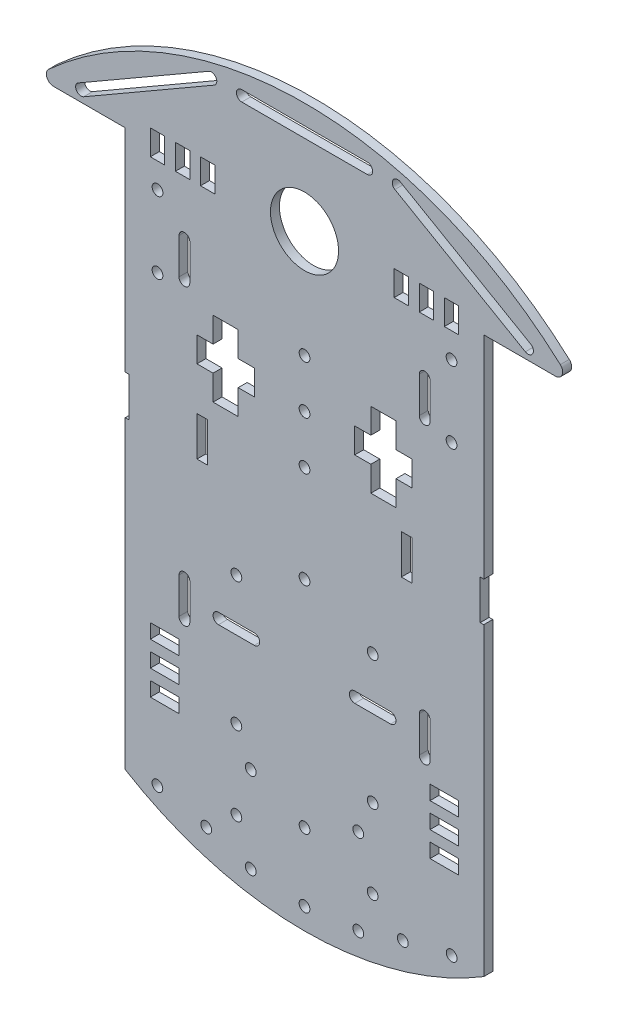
SolidWorks part; units mm, degrees
ref_plane "Plan de face" through (0, 0, 0) normal (0, 0, 1) x (1, 0, 0)
ref_plane "Plan de dessus" through (0, 0, 0) normal (0, 1, 0) x (1, 0, 0)
ref_plane "Plan de droite" through (0, 0, 0) normal (1, 0, 0) x (0, 0, -1)
sketch "Esquisse1" plane through (0, 0, 0) normal (0, 0, 1) x (1, 0, 0)
  line L0 (100, 155) -> (119.9942, 155)
  line L1 (100, 77.5) -> (0, 77.5) construction
  line L2 (0, 0) -> (0, 155)
  line L3 (0, 155) -> (-19.9942, 155)
  line L4 (100, 0) -> (100, 155)
  line L5 (125, 155) -> (-25, 155) construction
  line L6 (125, 186) -> (-25, 186) construction
  line L7 (50, -14) -> (169.1274, -14) construction
  line L8 (50, 155) -> (50, 123.7315) construction
  arc A0 (121.3374, 158.4819) -> (-21.3374, 158.4819) centre (50, 79.7742) ccw
  arc A1 (100, 0) -> (0, 0) centre (50, 82.2857) cw
  arc A2 (-21.3374, 158.4819) -> (-19.9942, 155) centre (-19.9942, 157) ccw
  arc A3 (119.9942, 155) -> (121.3374, 158.4819) centre (119.9942, 157) ccw
  dimension "D3" = 200
  dimension "D5" = 31
  dimension "D1" = 2
  dimension "D2" = 100
  dimension "D4" = 150
  dimension "D6" = 155
extrude "Boss.-Extru.1" add sketch "Esquisse1" along normal blind 2.5 contours L4 L0 A3 A0 A2 L3 L2 A1
sketch "Esquisse2" plane through (0, 0, 0) normal (0, 0, -1) x (-1, 0, 0)
  line L0 (-100, 155) -> (0, 155) construction
  line L1 (-50, 155) -> (-50, 122.9953) construction
  circle A0 centre (-50, 155) radius 9.5
  point P6 (-50, 155)
  dimension "D1" = 19
extrude "Enlèv. mat.-Extru.1" cut sketch "Esquisse2" against normal through all
sketch "Esquisse3" plane through (0, 0, 0) normal (0, 0, -1) x (-1, 0, 0)
  line L1 (-93, 158.5) -> (-89, 158.5)
  line L2 (-93, 158.5) -> (-93, 151.5)
  line L3 (-93, 151.5) -> (-89, 151.5)
  line L4 (-89, 158.5) -> (-89, 151.5)
  line L5 (-100, 0) -> (-100, 155) construction
  line L11 (-100, 155) -> (-88.6993, 155) construction
  point P8 (-93, 155)
  dimension "D1" = 7
  dimension "D2" = 4
  dimension "D3" = 7
extrude "Enlèv. mat.-Extru.2" cut sketch "Esquisse3" against normal through all
pattern_linear "Répétition linéaire1" count 3 spacing 7 along (-1, 0, 0) of "Enlèv. mat.-Extru.2"
sketch "Esquisse4" plane through (0, 0, 0) normal (0, 0, -1) x (-1, 0, 0)
  line L0 (-75.5, 122) -> (-68.5, 122)
  line L1 (-68.5, 122) -> (-68.5, 115)
  line L2 (-68.5, 115) -> (-64, 115)
  line L3 (-64, 115) -> (-64, 108)
  line L4 (-64, 108) -> (-68.5, 108)
  line L5 (-68.5, 108) -> (-68.5, 101)
  line L6 (-68.5, 101) -> (-75.5, 101)
  line L7 (-75.5, 101) -> (-75.5, 108)
  line L8 (-75.5, 108) -> (-80, 108)
  line L9 (-80, 108) -> (-80, 115)
  line L10 (-80, 115) -> (-75.5, 115)
  line L11 (-75.5, 115) -> (-75.5, 122)
  line L12 (-100, 155) -> (-119.9942, 155) construction
  line L13 (-72, 122) -> (-72, 101) construction
  line L14 (-80, 111.5) -> (-64, 111.5) construction
  line L15 (-100, 0) -> (-100, 155) construction
  point P19 (-72, 111.5)
  point P21 (-72, 111.5)
  dimension "D1" = 47
  dimension "D2" = 7
  dimension "D3" = 16
  dimension "D4" = 21
  dimension "D5" = 7
  dimension "D6" = 20
extrude "Enlèv. mat.-Extru.3" cut sketch "Esquisse4" against normal through all
sketch "Esquisse5" plane through (0, 0, 0) normal (0, 0, -1) x (-1, 0, 0)
  line L0 (-80, 108) -> (-75.5, 108) construction
  line L1 (-80, 96) -> (-77, 96)
  line L2 (-80, 96) -> (-80, 85)
  line L3 (-80, 85) -> (-77, 85)
  line L4 (-77, 96) -> (-77, 85)
  line L5 (-100, 0) -> (-100, 155) construction
  dimension "D1" = 12
  dimension "D2" = 3
  dimension "D3" = 11
  dimension "D4" = 20
extrude "Enlèv. mat.-Extru.4" cut sketch "Esquisse5" against normal through all
pattern_linear "Répétition linéaire2" count 2 spacing 22 along (1, 0, 0) of "Enlèv. mat.-Extru.4"
sketch "Esquisse6" plane through (0, 0, 0) normal (0, 0, -1) x (-1, 0, 0)
  line L0 (-65, 17.5) -> (-65, 7.0648) construction
  line L1 (-100, 0) -> (-100, 85) construction
  line L2 (-83.5, 54.5) -> (-83.5, 44.5) construction
  line L3 (-82, 54.5) -> (-82, 44.5)
  line L4 (-85, 54.5) -> (-85, 44.5)
  line L5 (-74, 49.5) -> (-64, 49.5) construction
  line L6 (-74, 51) -> (-64, 51)
  line L7 (-74, 48) -> (-64, 48)
  line L8 (-83.5, 136.5) -> (-83.5, 126.5) construction
  line L9 (-82, 136.5) -> (-82, 126.5)
  line L10 (-85, 136.5) -> (-85, 126.5)
  line L11 (-112.3374, 158) -> (-75.9643, 179) construction
  line L12 (-113.0874, 159.299) -> (-76.7143, 180.299)
  line L13 (-111.5874, 156.701) -> (-75.2143, 177.701)
  line L14 (-112.3374, 158) -> (-68.1921, 158) construction
  line L15 (-100, 155) -> (-119.9942, 155) construction
  line L16 (-91, 151.5) -> (-91, 144.5) construction
  line L17 (-93, 151.5) -> (-89, 151.5) construction
  line L19 (-69, 49.5) -> (-69, 65.1561) construction
  line L20 (-50, 89.2969) -> (-50, -6.5) construction
  line L21 (0, 0) -> (0, 155) construction
  circle A0 centre (-91, 144.5) radius 1.5
  arc A1 (-82, 54.5) -> (-85, 54.5) centre (-83.5, 54.5) ccw
  circle A2 centre (-91, 124.5) radius 1.5
  circle A3 centre (-65, 17.5) radius 1.5
  circle A4 centre (-69, 26.5) radius 1.5
  circle A5 centre (-91.03, 0.6026) radius 1.5
  circle A6 centre (-77.4014, -2.6005) radius 1.5
  circle A7 centre (-69, 4.5) radius 1.5
  circle A8 centre (-65, -6.5) radius 1.5
  arc A9 (-85, 44.5) -> (-82, 44.5) centre (-83.5, 44.5) ccw
  arc A10 (-74, 51) -> (-74, 48) centre (-74, 49.5) ccw
  arc A11 (-64, 48) -> (-64, 51) centre (-64, 49.5) ccw
  arc A12 (-82, 136.5) -> (-85, 136.5) centre (-83.5, 136.5) ccw
  arc A13 (-85, 126.5) -> (-82, 126.5) centre (-83.5, 126.5) ccw
  arc A14 (-113.0874, 159.299) -> (-111.5874, 156.701) centre (-112.3374, 158) ccw
  arc A15 (-75.2143, 177.701) -> (-76.7143, 180.299) centre (-75.9643, 179) ccw
  circle A16 centre (-69, 62.5) radius 1.5
  point P21 (-83.5, 49.5)
  point P26 (-69, 49.5)
  point P33 (-83.5, 131.5)
  point P40 (-94.1508, 168.5)
  dimension "D1" = 3
  dimension "D2" = 3
  dimension "D3" = 3
  dimension "D4" = 3
  dimension "D5" = 3
  dimension "D6" = 3
  dimension "D7" = 3
  dimension "D10" = 3
  dimension "D11" = 3
  dimension "D28" = 3
  dimension "D8" = 24
  dimension "D9" = 15
  dimension "D12" = 3
  dimension "D13" = 3
  dimension "D14" = 3
  dimension "D15" = 15
  dimension "D16" = 8
  dimension "D17" = 10
  dimension "D18" = 10
  dimension "D19" = 10
  dimension "D20" = 42
  dimension "D21" = 3
  dimension "D22" = 9
  dimension "D23" = 30
  dimension "D24" = 7
  dimension "D25" = 15
  dimension "D26" = 20
  dimension "D27" = 72
  dimension "D29" = 11.5
  dimension "D30" = 21.5
  dimension "D31" = 137.5
  dimension "D32" = 14
  dimension "D33" = 13
  dimension "D34" = 11
  dimension "D35" = 22
  dimension "D36" = 34
extrude "Enlèv. mat.-Extru.5" cut sketch "Esquisse6" against normal through all
sketch "Esquisse7" plane through (0, 0, 0) normal (0, 0, -1) x (-1, 0, 0)
  line L0 (-100, 0) -> (-100, 85) construction
  line L5 (-93, 39) -> (-85, 39)
  line L6 (-93, 39) -> (-93, 35)
  line L7 (-93, 35) -> (-85, 35)
  line L8 (-85, 39) -> (-85, 35)
  line L9 (-93, 32) -> (-85, 32)
  line L10 (-93, 32) -> (-93, 28)
  line L11 (-93, 28) -> (-85, 28)
  line L12 (-85, 32) -> (-85, 28)
  line L13 (-93, 25) -> (-85, 25)
  line L14 (-93, 25) -> (-93, 21)
  line L15 (-93, 21) -> (-85, 21)
  line L16 (-85, 25) -> (-85, 21)
  arc A0 (-100, 0) -> (0, 0) centre (-50, 82.2857) ccw construction
  point P18 (-50, -14)
  dimension "D1" = 4
  dimension "D2" = 4
  dimension "D3" = 4
  dimension "D4" = 8
  dimension "D5" = 7
  dimension "D6" = 3
  dimension "D7" = 3
  dimension "D8" = 35
extrude "Enlèv. mat.-Extru.6" cut sketch "Esquisse7" against normal through all
ref_plane "Plan1" through (50, 0, 0) normal (1, 0, 0) x (0, 0, -1)
mirror "Symétrie1" about plane through (50, 0, 0) normal (1, 0, 0) of "Répétition linéaire2", "Enlèv. mat.-Extru.2", "Répétition linéaire1", "Enlèv. mat.-Extru.3", "Enlèv. mat.-Extru.4", "Enlèv. mat.-Extru.5", "Enlèv. mat.-Extru.6"
sketch "Esquisse8" plane through (0, 0, 0) normal (0, 0, -1) x (-1, 0, 0)
  line L0 (-67.5, 178.9806) -> (-32.5, 178.9806) construction
  line L1 (-67.5, 180.4806) -> (-32.5, 180.4806)
  line L2 (-67.5, 177.4806) -> (-32.5, 177.4806)
  line L5 (-50, 251.8346) -> (-50, 106.1266) construction
  line L6 (0, 0) -> (0, 85) construction
  line L7 (-100, 96) -> (-100, 155) construction
  line L8 (-64, 111.5) -> (-36, 111.5) construction
  line L9 (-64, 108) -> (-64, 115) construction
  line L10 (-36, 108) -> (-36, 115) construction
  arc A0 (-67.5, 180.4806) -> (-67.5, 177.4806) centre (-67.5, 178.9806) ccw
  arc A1 (-32.5, 177.4806) -> (-32.5, 180.4806) centre (-32.5, 178.9806) ccw
  circle A2 centre (-50, 111.5) radius 1.5
  circle A3 centre (-50, 125) radius 1.5
  circle A4 centre (-50, 98) radius 1.5
  circle A5 centre (-50, 71) radius 1.5
  circle A6 centre (-50, -8) radius 1.5
  circle A7 centre (-50, 11) radius 1.5
  point P2 (-50, 178.9806)
  dimension "D3" = 3
  dimension "D4" = 3
  dimension "D5" = 3
  dimension "D6" = 3
  dimension "D7" = 3
  dimension "D11" = 3
  dimension "D1" = 3
  dimension "D2" = 35
  dimension "D8" = 13.5
  dimension "D9" = 13.5
  dimension "D10" = 27
  dimension "D12" = 60
  dimension "D13" = 19
extrude "Enlèv. mat.-Extru.7" cut sketch "Esquisse8" against normal blind 10
equation "\"D2@Esquisse6\"=\"D1@Esquisse6\""
equation "\"D3@Esquisse6\"=\"D2@Esquisse6\""
equation "\"D4@Esquisse6\"=\"D2@Esquisse6\""
equation "\"D5@Esquisse6\"=\"D2@Esquisse6\""
equation "\"D6@Esquisse6\"=\"D2@Esquisse6\""
equation "\"D7@Esquisse6\"=\"D2@Esquisse6\""
equation "\"D2@Esquisse7\"=\"D1@Esquisse7\""
equation "\"D3@Esquisse7\"=\"D1@Esquisse7\""
equation "\"D10@Esquisse6\"=\"D7@Esquisse6\""
equation "\"D12@Esquisse6\"=\"D11@Esquisse6\""
equation "\"D13@Esquisse6\"=\"D11@Esquisse6\""
equation "\"D14@Esquisse6\"=\"D11@Esquisse6\""
equation "\"D17@Esquisse6\"=\"D19@Esquisse6\""
equation "\"D18@Esquisse6\"=\"D19@Esquisse6\""
equation "\"D28@Esquisse6\"=\"D1@Esquisse6\""
equation "\"D4@Esquisse8\"=\"D3@Esquisse8\""
equation "\"D5@Esquisse8\"=\"D3@Esquisse8\""
equation "\"D6@Esquisse8\"=\"D3@Esquisse8\""
equation "\"D7@Esquisse8\"=\"D3@Esquisse8\""
equation "\"D11@Esquisse8\"=\"D6@Esquisse8\""
